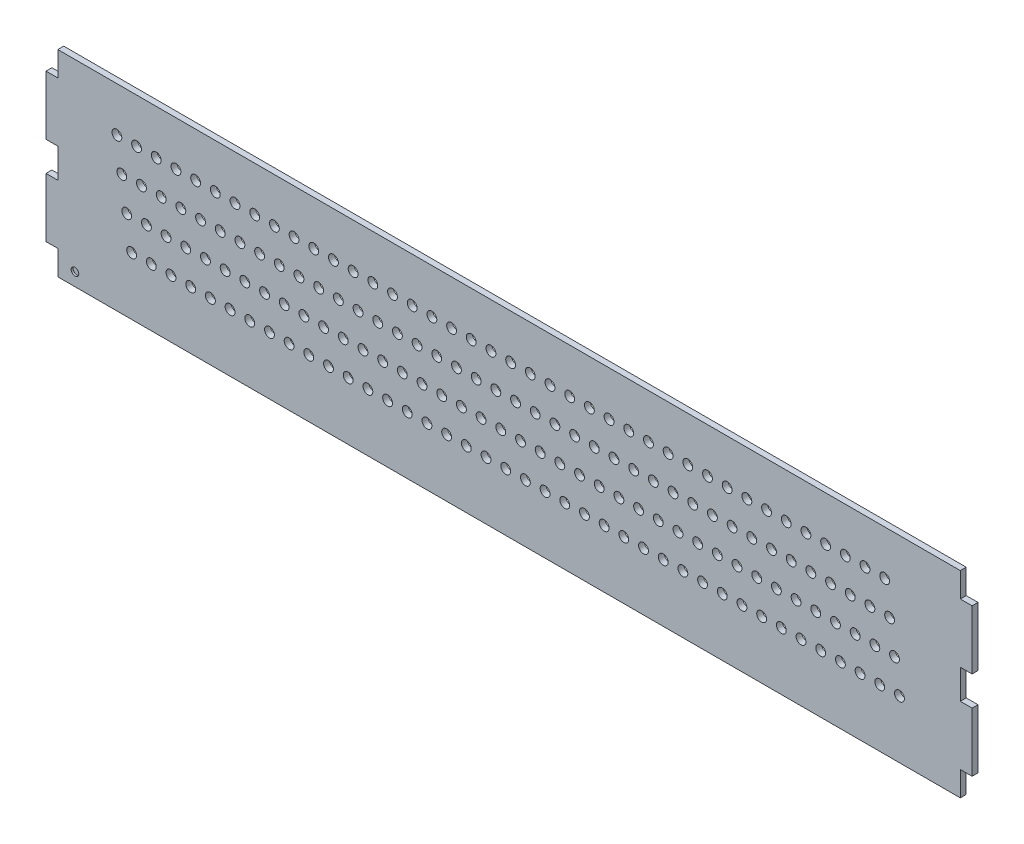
SolidWorks part; units mm, degrees
ref_plane "Alzado" through (0, 0, 0) normal (0, 0, 1) x (1, 0, 0)
ref_plane "Planta" through (0, 0, 0) normal (0, 1, 0) x (1, 0, 0)
ref_plane "Vista lateral" through (0, 0, 0) normal (1, 0, 0) x (0, 0, -1)
sketch "Croquis1" plane through (0, 0, 0) normal (0, 0, 1) x (1, 0, 0)
  line L1 (-229.2, -50) -> (229.2, -50)
  line L2 (-229.2, -50) -> (-229.2, 50)
  line L3 (-229.2, 50) -> (229.2, 50)
  line L4 (229.2, -50) -> (229.2, 50)
  line L5 (-229.2, -50) -> (229.2, 50) construction
  line L6 (-229.2, 50) -> (229.2, -50) construction
  point P0 (0, 0)
  dimension "D1" = 100
  dimension "D2" = 458.4
extrude "Saliente-Extruir1" add sketch "Croquis1" along normal blind 3
sketch "Croquis2" plane through (-229.2, 0, 0) normal (-1, 0, 0) x (0, 0, 1)
  line L0 (3, 50) -> (3, -50) construction
  line L1 (3, 37.5) -> (0, 37.5)
  line L2 (3, 37.5) -> (3, 7.5)
  line L3 (3, 7.5) -> (0, 7.5)
  line L4 (0, 37.5) -> (0, 7.5)
  line L5 (0, 50) -> (0, -50) construction
  line L6 (0, 7.5) -> (0, -7.5) construction
  line L7 (3, -7.5) -> (0, -7.5)
  line L8 (3, -7.5) -> (3, -37.5)
  line L9 (3, -37.5) -> (0, -37.5)
  line L10 (0, -7.5) -> (0, -37.5)
  point P12 (0, 0)
  point P13 (0, 22.5)
  point P15 (0, -22.5)
  dimension "D1" = 30
  dimension "D2" = 30
  dimension "D3" = 45
extrude "Saliente-Extruir2" add sketch "Croquis2" along normal blind 6
sketch "Croquis3" plane through (229.2, 0, 0) normal (1, 0, 0) x (0, 0, -1)
  line L0 (-3, -50) -> (-3, 50) construction
  line L1 (-3, -37.5) -> (0, -37.5)
  line L2 (-3, -37.5) -> (-3, -7.5)
  line L3 (-3, -7.5) -> (0, -7.5)
  line L4 (0, -37.5) -> (0, -7.5)
  line L5 (0, -50) -> (0, 50) construction
  line L6 (0, -7.5) -> (0, 7.5) construction
  line L7 (-3, 7.5) -> (0, 7.5)
  line L8 (-3, 7.5) -> (-3, 37.5)
  line L9 (-3, 37.5) -> (0, 37.5)
  line L10 (0, 7.5) -> (0, 37.5)
  point P12 (0, 0)
  point P13 (0, -22.5)
  point P15 (0, 22.5)
  dimension "D1" = 30
  dimension "D2" = 30
  dimension "D3" = 45
extrude "Saliente-Extruir3" add sketch "Croquis3" along normal blind 6
sketch "Croquis4" plane through (0, 0, 3) normal (0, 0, 1) x (1, 0, 0)
  line L0 (-229.2, 50) -> (-229.2, 37.5) construction
  line L1 (229.2, 50) -> (-229.2, 50) construction
  circle A0 centre (-199.2, 27.4) radius 2.5
  circle A1 centre (-196.7, 11.4) radius 2.5
  circle A2 centre (-194.2, -4.6) radius 2.5
  circle A3 centre (-191.7, -20.6) radius 2.5
  dimension "D1" = 5
  dimension "D2" = 5
  dimension "D3" = 5
  dimension "D4" = 5
  dimension "D7" = 2.5
  dimension "D8" = 16
  dimension "D9" = 2.5
  dimension "D10" = 16
  dimension "D11" = 16
  dimension "D12" = 2.5
  dimension "D5" = 30
  dimension "D6" = 22.6
extrude "Cortar-Extruir1" cut sketch "Croquis4" against normal up to next
pattern_linear "MatrizL1" count 40 spacing 10 along (1, 0, 0) of "Cortar-Extruir1"
sketch "Croquis5" plane through (0, 0, 3) normal (0, 0, 1) x (1, 0, 0)
  circle A0 centre (-220.4784, -43.3748) radius 1.9347
extrude "Cortar-Extruir2" cut sketch "Croquis5" against normal blind 1
